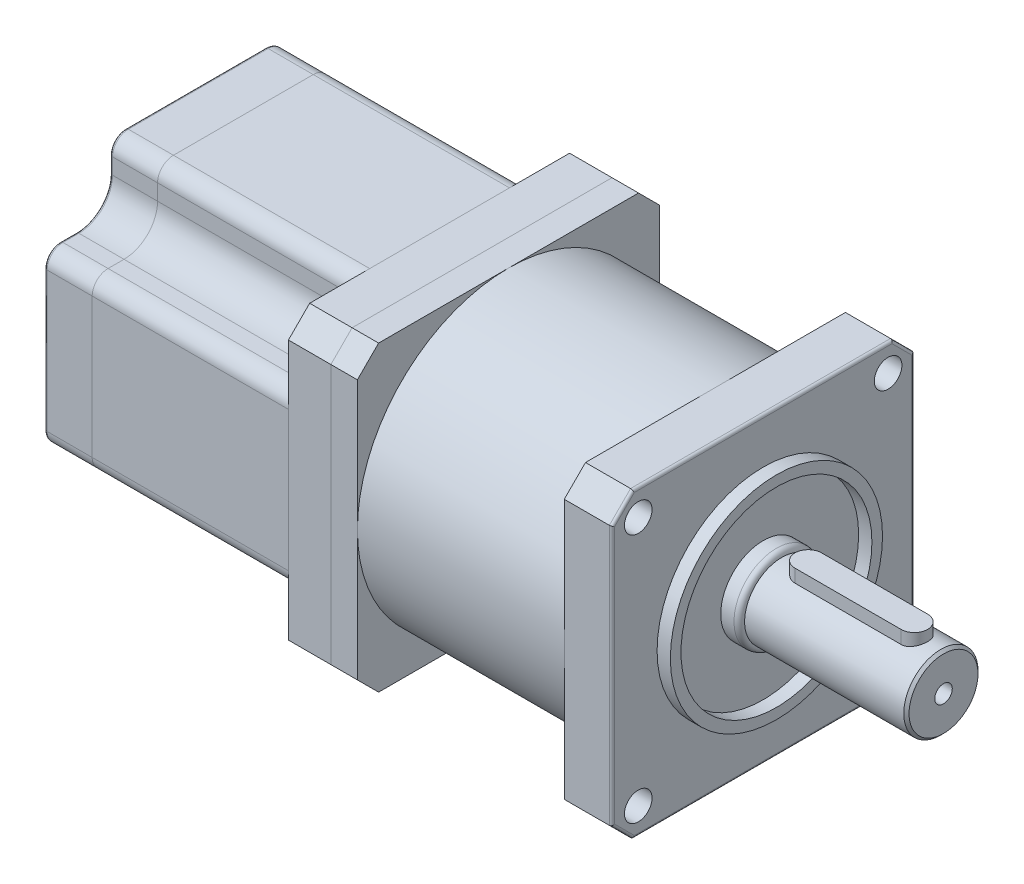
SolidWorks part; units mm, degrees
ref_plane "前视基准面" through (0, 0, 0) normal (0, 0, 1) x (1, 0, 0)
ref_plane "上视基准面" through (0, 0, 0) normal (0, 1, 0) x (1, 0, 0)
ref_plane "右视基准面" through (0, 0, 0) normal (1, 0, 0) x (0, 0, -1)
sketch "草图1" plane through (0, 0, 0) normal (1, 0, 0) x (0, 0, -1)
  line L0 (-28.5, 24.5) -> (-24.5, 28.5)
  line L1 (-24.5, -28.5) -> (24.5, -28.5)
  line L2 (-28.5, -24.5) -> (-28.5, 24.5)
  line L3 (-24.5, 28.5) -> (24.5, 28.5)
  line L4 (28.5, -24.5) -> (28.5, 24.5)
  line L5 (-28.5, -28.5) -> (28.5, 28.5) construction
  line L6 (-28.5, 28.5) -> (28.5, -28.5) construction
  line L7 (24.5, 28.5) -> (28.5, 24.5)
  line L8 (24.5, -28.5) -> (28.5, -24.5)
  line L9 (-28.5, -24.5) -> (-24.5, -28.5)
  point P0 (0, 0)
extrude "凸台-拉伸1" add sketch "草图1" against normal blind 9
sketch "草图2" plane through (-9, 0, 0) normal (-1, 0, 0) x (0, 0, 1)
  circle A0 centre (0, 0) radius 28.5
extrude "凸台-拉伸2" add sketch "草图2" along normal blind 39
sketch "草图3" plane through (-48, 0, 0) normal (-1, 0, 0) x (0, 0, 1)
  line L0 (0, 28.5) -> (24.5, 28.5) construction
  line L1 (-24.5, -28.5) -> (24.5, -28.5)
  line L2 (-28.5, -24.5) -> (-28.5, 24.5)
  line L3 (-24.5, 28.5) -> (24.5, 28.5)
  line L4 (28.5, -24.5) -> (28.5, 24.5)
  line L5 (-28.5, -28.5) -> (28.5, 28.5) construction
  line L6 (-28.5, 28.5) -> (28.5, -28.5) construction
  line L7 (-28.5, 24.5) -> (-24.5, 28.5)
  line L8 (24.5, 28.5) -> (28.5, 24.5)
  line L9 (24.5, -28.5) -> (28.5, -24.5)
  line L10 (-28.5, -24.5) -> (-24.5, -28.5)
  point P0 (0, 0)
extrude "凸台-拉伸3" add sketch "草图3" along normal blind 5
sketch "草图4" plane through (-53, 0, 0) normal (-1, 0, 0) x (0, 0, 1)
  line L0 (24.5, 28.5) -> (-24.5, 28.5) construction
  line L1 (-24.5, -28.5) -> (24.5, -28.5)
  line L2 (-28.5, -24.5) -> (-28.5, 24.5)
  line L3 (-24.5, 28.5) -> (24.5, 28.5)
  line L4 (28.5, -24.5) -> (28.5, 24.5)
  line L5 (-28.5, -28.5) -> (28.5, 28.5) construction
  line L6 (-28.5, 28.5) -> (28.5, -28.5) construction
  line L7 (-28.5, 24.5) -> (-24.5, 28.5)
  line L8 (24.5, 28.5) -> (28.5, 24.5)
  line L9 (24.5, -28.5) -> (28.5, -24.5)
  line L10 (-28.5, -24.5) -> (-24.5, -28.5)
  point P0 (0, 0)
extrude "凸台-拉伸4" add sketch "草图4" along normal blind 8 separate body
sketch "草图5" plane through (-61, 0, 0) normal (-1, 0, 0) x (0, 0, 1)
  line L0 (24.5, 28.5) -> (-24.5, 28.5) construction
  line L1 (-24.5, -28.5) -> (24.5, -28.5)
  line L2 (-28.5, -24.5) -> (-28.5, 24.5)
  line L3 (-24.5, 28.5) -> (24.5, 28.5)
  line L4 (28.5, -24.5) -> (28.5, 24.5)
  line L5 (-28.5, -28.5) -> (28.5, 28.5) construction
  line L6 (-28.5, 28.5) -> (28.5, -28.5) construction
  line L7 (-28.5, 24.5) -> (-24.5, 28.5)
  line L8 (-24.5, -28.5) -> (-28.5, -24.5)
  line L9 (24.5, -28.5) -> (28.5, -24.5)
  line L10 (28.5, 24.5) -> (24.5, 28.5)
  point P0 (0, 0)
extrude "凸台-拉伸5" add sketch "草图5" along normal blind 37 separate body
sketch "草图6" plane through (-98, 0, 0) normal (-1, 0, 0) x (0, 0, 1)
  line L0 (24.5, 28.5) -> (-24.5, 28.5) construction
  line L1 (-24.5, -28.5) -> (24.5, -28.5)
  line L2 (-28.5, -24.5) -> (-28.5, 24.5)
  line L3 (-24.5, 28.5) -> (24.5, 28.5)
  line L4 (28.5, -24.5) -> (28.5, 24.5)
  line L5 (-28.5, -28.5) -> (28.5, 28.5) construction
  line L6 (-28.5, 28.5) -> (28.5, -28.5) construction
  line L7 (-28.5, 24.5) -> (-24.5, 28.5)
  line L8 (-24.5, -28.5) -> (-28.5, -24.5)
  line L9 (24.5, -28.5) -> (28.5, -24.5)
  line L10 (28.5, 24.5) -> (24.5, 28.5)
  point P0 (0, 0)
extrude "凸台-拉伸6" add sketch "草图6" along normal blind 9 separate body
sketch "草图7" plane through (-107, 0, 0) normal (-1, 0, 0) x (0, 0, 1)
  line L0 (-22.5, 16.1754) -> (-25.5, 16.1754)
  line L1 (-28.5, 13.1754) -> (-28.5, 24.5)
  line L2 (-28.5, 24.5) -> (-24.5, 28.5)
  line L3 (-24.5, 28.5) -> (-13.1754, 28.5)
  line L4 (13.1754, 28.5) -> (24.5, 28.5)
  line L5 (24.5, 28.5) -> (28.5, 24.5)
  line L6 (28.5, 24.5) -> (28.5, 13.1754)
  line L7 (-28.5, 24.5) -> (-28.5, -24.5) construction
  line L9 (-25.5, -16.1754) -> (-22.5, -16.1754)
  line L10 (28.5, -13.1754) -> (28.5, -24.5)
  line L11 (-16.1754, -22.5) -> (-16.1754, -25.5)
  line L12 (-24.5, -28.5) -> (24.5, -28.5) construction
  line L14 (16.1754, -25.5) -> (16.1754, -22.5)
  line L15 (28.5, -24.5) -> (24.5, -28.5)
  line L16 (22.5, -16.1754) -> (25.5, -16.1754)
  line L17 (28.5, -24.5) -> (28.5, 24.5) construction
  line L19 (25.5, 16.1754) -> (22.5, 16.1754)
  line L20 (24.5, -28.5) -> (13.1754, -28.5)
  line L21 (16.1754, 22.5) -> (16.1754, 25.5)
  line L22 (24.5, 28.5) -> (-24.5, 28.5) construction
  line L24 (-16.1754, 25.5) -> (-16.1754, 22.5)
  line L25 (-13.1754, -28.5) -> (-24.5, -28.5)
  line L26 (-24.5, -28.5) -> (-28.5, -24.5)
  line L27 (-28.5, -24.5) -> (-28.5, -13.1754)
  arc A0 (-22.5, 16.1754) -> (-16.1754, 22.5) centre (-22.5, 22.5) ccw
  arc A1 (16.1754, 22.5) -> (22.5, 16.1754) centre (22.5, 22.5) ccw
  arc A2 (22.5, -16.1754) -> (16.1754, -22.5) centre (22.5, -22.5) ccw
  arc A3 (-16.1754, -22.5) -> (-22.5, -16.1754) centre (-22.5, -22.5) ccw
  arc A4 (-13.1754, 28.5) -> (-16.1754, 25.5) centre (-13.1754, 25.5) ccw
  arc A5 (16.1754, 25.5) -> (13.1754, 28.5) centre (13.1754, 25.5) ccw
  arc A6 (28.5, 13.1754) -> (25.5, 16.1754) centre (25.5, 13.1754) ccw
  arc A7 (25.5, -16.1754) -> (28.5, -13.1754) centre (25.5, -13.1754) ccw
  arc A8 (13.1754, -28.5) -> (16.1754, -25.5) centre (13.1754, -25.5) ccw
  arc A9 (-16.1754, -25.5) -> (-13.1754, -28.5) centre (-13.1754, -25.5) ccw
  arc A10 (-28.5, -13.1754) -> (-25.5, -16.1754) centre (-25.5, -13.1754) ccw
  arc A11 (-25.5, 16.1754) -> (-28.5, 13.1754) centre (-25.5, 13.1754) ccw
  point P0 (0, 0)
  point P10 (-16.1754, 28.5)
  point P39 (16.1754, 28.5)
  point P42 (28.5, 16.1754)
  point P45 (28.5, -16.1754)
  point P48 (16.1754, -28.5)
  point P51 (-16.1754, -28.5)
  point P54 (-28.5, -16.1754)
  point P57 (-28.5, 16.1754)
  dimension "D1" = 3
extrude "切除-拉伸1" cut sketch "草图7" against normal blind 46
fillet "圆角1" radius 0.5 24 edges at (-107, 28.5, 0) (-107, 27.6213, 15.2968) (-107, 24, 16.1754) (-107, 18.0279, 18.0279) (-107, 16.1754, 24) (-107, 15.2968, 27.6213) (-107, 0, 28.5) (-107, -15.2968, 27.6213) (-107, -16.1754, 24) (-107, -18.0279, 18.0279) (-107, -24, 16.1754) (-107, -27.6213, 15.2968) (-107, -28.5, 0) (-107, -27.6213, -15.2968) (-107, -24, -16.1754) (-107, -18.0279, -18.0279) (-107, -16.1754, -24) (-107, -15.2968, -27.6213) (-107, 0, -28.5) (-107, 15.2968, -27.6213) (-107, 16.1754, -24) (-107, 18.0279, -18.0279) (-107, 24, -16.1754) (-107, 27.6213, -15.2968)
fillet "圆角2" radius 0.5 8 edges at (0, 26.5, -26.5) (0, 0, -28.5) (0, -26.5, -26.5) (0, -28.5, 0) (0, -26.5, 26.5) (0, 0, 28.5) (0, 26.5, 26.5) (0, 28.5, 0)
sketch "草图8" plane through (0, 0, 0) normal (1, 0, 0) x (0, 0, -1)
  circle A0 centre (-23.55, 23.55) radius 2.6
  circle A1 centre (23.55, 23.55) radius 2.6
  circle A2 centre (23.55, -23.55) radius 2.6
  circle A3 centre (-23.55, -23.55) radius 2.6
  point P0 (0, 0)
extrude "切除-拉伸2" cut sketch "草图8" against normal blind 9
sketch "草图9" plane through (0, 0, 0) normal (1, 0, 0) x (0, 0, -1)
  circle A0 centre (0, 0) radius 20
  circle A1 centre (0, 0) radius 18
extrude "凸台-拉伸7" add sketch "草图9" along normal blind 2.5
sketch "草图10" plane through (0, 0, 0) normal (1, 0, 0) x (0, 0, -1)
  circle A0 centre (0, 0) radius 8
extrude "凸台-拉伸8" add sketch "草图10" along normal blind 3.5
fillet "圆角3" radius 1 1 edges at (3.5, 0, -8)
sketch "草图11" plane through (3.5, 0, 0) normal (1, 0, 0) x (0, 0, -1)
  circle A0 centre (0, 0) radius 7
extrude "凸台-拉伸9" add sketch "草图11" along normal blind 30.5 separate body
ref_plane "基准面1" through (0, 7, 0) normal (0, 1, 0) x (1, 0, 0)
sketch "草图12" plane through (0, 7, 0) normal (0, 1, 0) x (1, 0, 0)
  line L4 (8.5, 2.5) -> (28.5, 2.5)
  line L6 (28.5, -2.5) -> (8.5, -2.5)
  arc A0 (28.5, -2.5) -> (28.5, 2.5) centre (28.5, 0) ccw
  arc A1 (8.5, 2.5) -> (8.5, -2.5) centre (8.5, 0) ccw
extrude "切除-拉伸3" cut sketch "草图12" against normal blind 3
sketch "草图13" plane through (0, 4, 0) normal (0, 1, 0) x (1, 0, 0)
  line L0 (28.5, 2.5) -> (8.5, 2.5)
  line L2 (8.5, -2.5) -> (28.5, -2.5)
  arc A0 (8.5, 2.5) -> (8.5, -2.5) centre (8.5, 0) ccw
  arc A1 (28.5, -2.5) -> (28.5, 2.5) centre (28.5, 0) ccw
extrude "凸台-拉伸10" add sketch "草图13" along normal blind 5 separate body
chamfer "倒角1" distance 0.5 angle 45 1 edges at (34, 0, -7)
sketch "草图14" plane through (34, 0, 0) normal (1, 0, 0) x (0, 0, -1)
  point P0 (0, 0)
hole_wizard "M4 螺纹孔1" positions "3D草图3" profile "草图16" tap size "M4" standard "GB"
sketch3d "3D草图3"
  point P0 (34, 0, 0)
sketch "草图16" plane through (34, 0, 0) normal (0, 1, 0) x (0, 0, -1)
  line L0 (0, 0) -> (0, 10.4914)
  line L1 (0, 10.4914) -> (1.65, 9.5)
  line L2 (1.65, 9.5) -> (1.65, 0)
  line L5 (1.65, 0) -> (0, 0)
  line L10 (0, 10.4914) -> (-1.65, 9.5) construction
  line L11 (0, -6.35) -> (0, 107.95) construction
  dimension "螺纹孔钻头直径" = 3.3
  dimension "螺纹孔钻头深度" = 9.5
  dimension "导头角度" = 118
